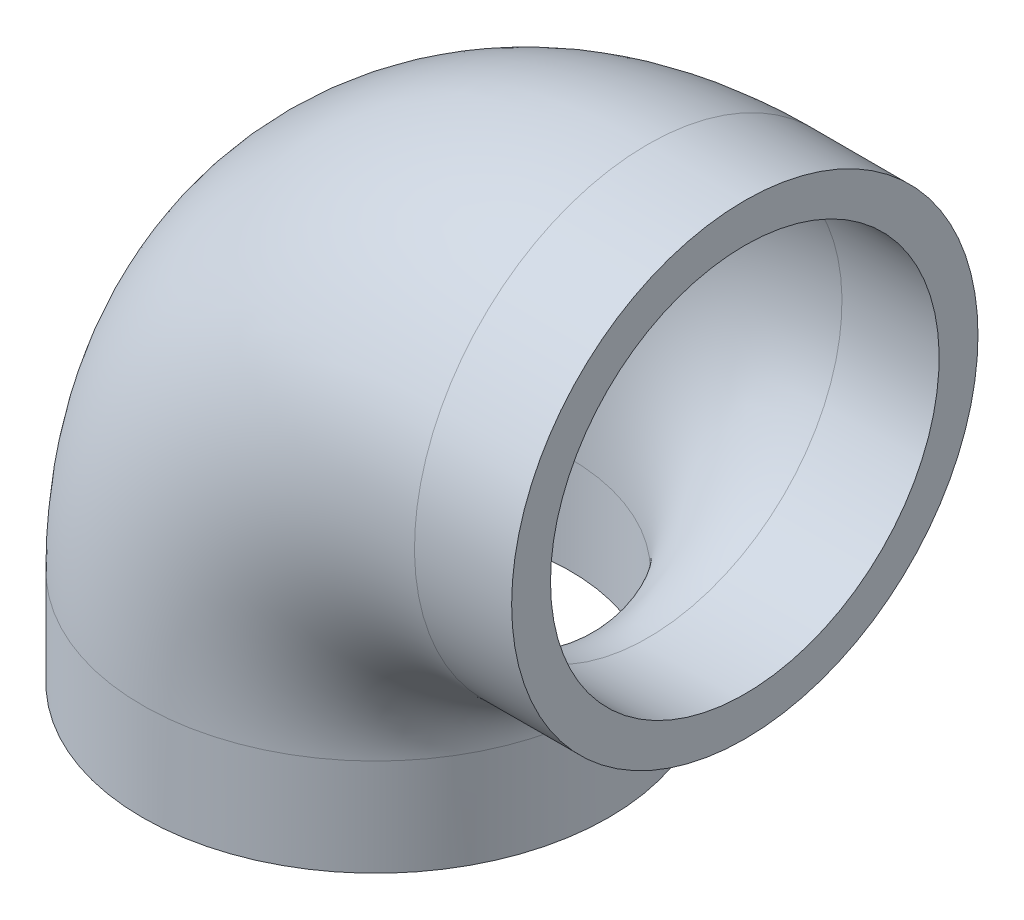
SolidWorks part; units mm, degrees
ref_plane "Front Plane" through (0, 0, 0) normal (0, 0, 1) x (1, 0, 0)
ref_plane "Top Plane" through (0, 0, 0) normal (0, 1, 0) x (1, 0, 0)
ref_plane "Right Plane" through (0, 0, 0) normal (1, 0, 0) x (0, 0, -1)
sketch "Sketch1" plane through (0, 0, 0) normal (0, 1, 0) x (1, 0, 0)
  circle A0 centre (0, 0) radius 12.7
  circle A1 centre (0, 0) radius 15.24
  dimension "D1" = 25.4
  dimension "D2" = 30.48
sketch "Sketch2" plane through (0, 0, 0) normal (0, 0, 1) x (1, 0, 0)
  line L0 (0, 0) -> (0, 6.35)
  line L1 (17.78, 24.13) -> (24.13, 24.13)
  arc A0 (0, 6.35) -> (17.78, 24.13) centre (17.78, 6.35) cw
  dimension "D2" = 17.78
  dimension "D1" = 6.35
sweep "Sweep1" add profiles "Sketch1" path "Sketch2"
